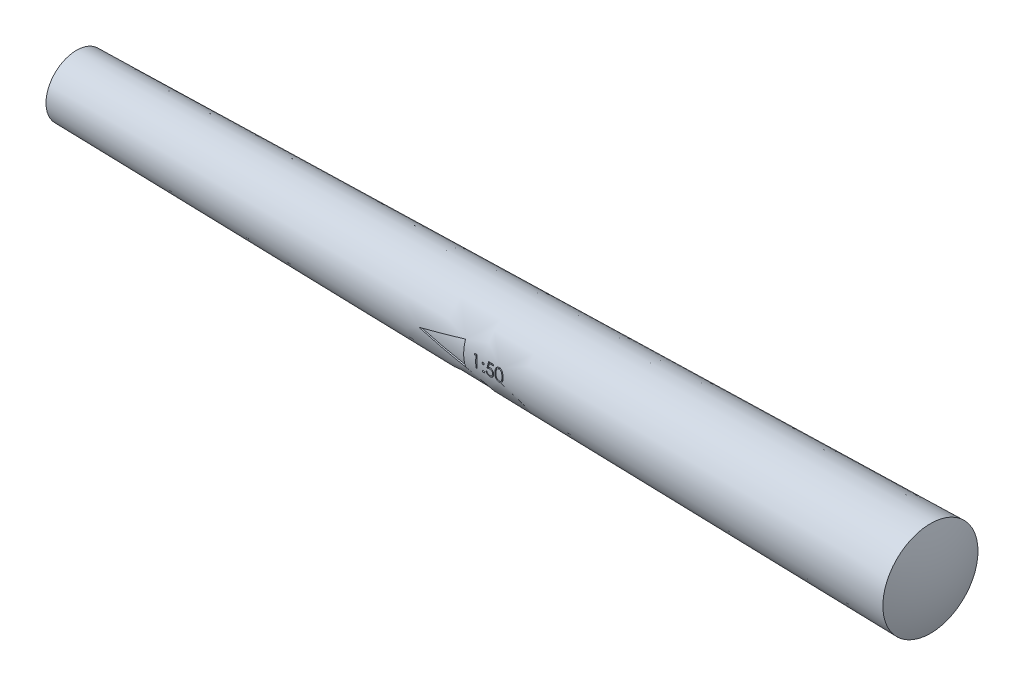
SolidWorks part; units mm, degrees
ref_plane "Front Plane" through (0, 0, 0) normal (0, 0, 1) x (1, 0, 0)
ref_plane "Top Plane" through (0, 0, 0) normal (0, 1, 0) x (1, 0, 0)
ref_plane "Right Plane" through (0, 0, 0) normal (1, 0, 0) x (0, 0, -1)
sketch "Sketch1" plane through (0, 0, 0) normal (1, 0, 0) x (0, 0, -1)
  circle A0 centre (0, 0) radius 2.5
  dimension "D1" = 5
extrude "Extrude1" add sketch "Sketch1" along normal mid plane 70
draft "Draft1" type of draft neutral plane draft angle 1.146 faces to draft 1 parameters "D1"=1.146
sketch "Sketch2" plane through (0, 0, 0) normal (0, 0, 1) x (1, 0, 0)
  line L0 (-35, 0) -> (-35, 2.5)
  line L1 (-35, 2.5) -> (-35, -2.5) construction
  line L2 (-35, 0) -> (-35.75, 0)
  line L3 (-35.75, 0) -> (-35.75, -3.2) construction
  line L4 (35, 0) -> (35, 3.9)
  line L5 (35, -3.9) -> (35, 3.9) construction
  line L6 (35, 0) -> (35.75, 0)
  line L7 (35.75, 0) -> (35.75, -3.2) construction
  line L8 (-35, -2.5) -> (35, -3.9) construction
  arc A0 (-35.75, 0) -> (-35, 2.5) centre (-31.2083, 0) cw
  arc A1 (35.75, 0) -> (35, 3.9) centre (25.2348, 0) ccw
  point P14 (0, -3.2)
revolve "Revolve1" add sketch "Sketch2" angle 360 about L2
sketch "Sketch5" plane through (0, 0, 0) normal (0, 0, 1) x (1, 0, 0)
  line L0 (0, 3.2) -> (0, -3.2) construction
  line L1 (35, 3.9) -> (-35, 2.5) construction
  line L2 (-35, -2.5) -> (35, -3.9) construction
ref_plane "Plane2" through (0, 0, 0) normal (-0.02, 0, 0.9998) x (0.9998, 0, 0.02)
sketch "Sketch6" plane through (0, 0, 0) normal (-0.02, 0, 0.9998) x (0.9998, 0, 0.02)
  line L0 (0, 0) -> (0, 1)
  line L1 (0, 3.2) -> (0, -3.2) construction
  line L2 (0, 1) -> (-3.7321, 0)
  line L3 (-3.7321, 0) -> (0, -1)
  line L4 (0, -1) -> (0, 0)
  line L5 (0, -0.5) -> (4, -0.5) construction
  text T0 "1:50" font "Century Gothic" height 1
  dimension "D1" = 2
  dimension "D2" = 30
  dimension "D3" = 4
wrap "Wrap2" sketch "Sketch6" wrap type deboss source sketch "Sketch6" thickness 0.1 parameters "D1"=0.1
equation "\"D2@Sketch2\" = \"D1@Sketch2\""
